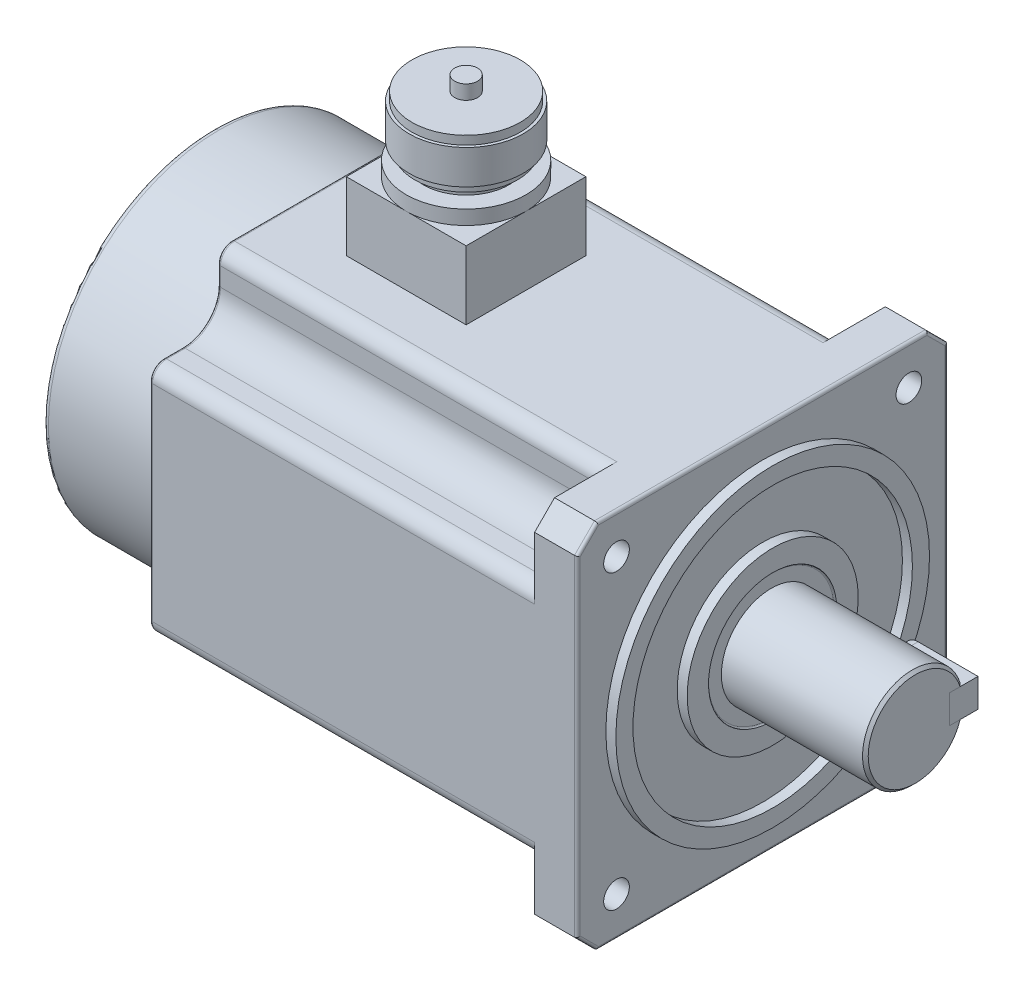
SolidWorks part; units mm, degrees
ref_plane "前视基准面" through (0, 0, 0) normal (0, 0, 1) x (1, 0, 0)
ref_plane "上视基准面" through (0, 0, 0) normal (0, 1, 0) x (1, 0, 0)
ref_plane "右视基准面" through (0, 0, 0) normal (1, 0, 0) x (0, 0, -1)
sketch "草图1" plane through (0, 0, 0) normal (1, 0, 0) x (0, 0, -1)
  line L0 (-65, 58) -> (-58, 65)
  line L1 (-58, -65) -> (58, -65)
  line L2 (-65, -58) -> (-65, 58)
  line L3 (-58, 65) -> (58, 65)
  line L4 (65, -58) -> (65, 58)
  line L5 (-65, -65) -> (65, 65) construction
  line L6 (-65, 65) -> (65, -65) construction
  line L7 (-58, -65) -> (-65, -58)
  line L8 (58, -65) -> (65, -58)
  line L9 (65, 58) -> (58, 65)
  point P0 (0, 0)
extrude "凸台-拉伸1" add sketch "草图1" against normal blind 150
sketch "草图2" plane through (-150, 0, 0) normal (-1, 0, 0) x (0, 0, 1)
  line L0 (-53.5, 41.1509) -> (-60, 41.1509)
  line L1 (-36.1509, 65) -> (-58, 65)
  line L2 (-41.1509, 53.5) -> (-41.1509, 60)
  line L3 (-58, 65) -> (58, 65) construction
  line L4 (-58, 65) -> (-65, 58)
  line L5 (41.1509, 60) -> (41.1509, 53.5)
  line L6 (-65, 58) -> (-58, 65) construction
  line L7 (-65, -58) -> (-65, 58) construction
  line L8 (53.5, 41.1509) -> (60, 41.1509)
  line L9 (-60, -41.1509) -> (-53.5, -41.1509)
  line L10 (-41.1509, -53.5) -> (-41.1509, -60)
  line L11 (58, -65) -> (-58, -65) construction
  line L12 (65, 58) -> (65, -58) construction
  line L13 (-65, 58) -> (-65, 36.1509)
  line L14 (60, -41.1509) -> (53.5, -41.1509)
  line L15 (-65, -36.1509) -> (-65, -58)
  line L16 (41.1509, -53.5) -> (41.1509, -60)
  line L17 (-65, -58) -> (-58, -65)
  line L18 (-58, -65) -> (-36.1509, -65)
  line L19 (36.1509, -65) -> (58, -65)
  line L20 (58, -65) -> (65, -58)
  line L21 (65, -58) -> (65, -36.1509)
  line L22 (65, 36.1509) -> (65, 58)
  line L23 (65, 58) -> (58, 65)
  line L24 (58, 65) -> (36.1509, 65)
  arc A0 (-53.5, 41.1509) -> (-41.1509, 53.5) centre (-53.5, 53.5) ccw
  arc A1 (41.1509, 53.5) -> (53.5, 41.1509) centre (53.5, 53.5) ccw
  arc A2 (53.5, -41.1509) -> (41.1509, -53.5) centre (53.5, -53.5) ccw
  arc A3 (-41.1509, -53.5) -> (-53.5, -41.1509) centre (-53.5, -53.5) ccw
  arc A4 (-41.1509, 60) -> (-36.1509, 65) centre (-36.1509, 60) cw
  arc A5 (36.1509, 65) -> (41.1509, 60) centre (36.1509, 60) cw
  arc A6 (60, 41.1509) -> (65, 36.1509) centre (60, 36.1509) cw
  arc A7 (65, -36.1509) -> (60, -41.1509) centre (60, -36.1509) cw
  arc A8 (36.1509, -65) -> (41.1509, -60) centre (36.1509, -60) ccw
  arc A9 (-36.1509, -65) -> (-41.1509, -60) centre (-36.1509, -60) cw
  arc A10 (-60, -41.1509) -> (-65, -36.1509) centre (-60, -36.1509) cw
  arc A11 (-65, 36.1509) -> (-60, 41.1509) centre (-60, 36.1509) cw
  point P0 (0, 0)
  point P10 (-41.1509, 65)
  point P39 (41.1509, 65)
  point P42 (65, 41.1509)
  point P45 (65, -41.1509)
  point P48 (41.1509, -65)
  point P51 (-41.1509, -65)
  point P54 (-65, -41.1509)
  point P57 (-65, 41.1509)
  dimension "D1" = 5
extrude "切除-拉伸1" cut sketch "草图2" against normal blind 135
fillet "圆角1" radius 1 8 edges at (0, 61.5, -61.5) (0, 0, -65) (0, -61.5, -61.5) (0, -65, 0) (0, -61.5, 61.5) (0, 0, 65) (0, 61.5, 61.5) (0, 65, 0)
fillet "圆角2" radius 1 24 edges at (-150, -44.7679, 44.7679) (-150, -56.75, 41.1509) (-150, -63.5355, 39.6864) (-150, -65, 0) (-150, -63.5355, -39.6864) (-150, -56.75, -41.1509) (-150, -44.7679, -44.7679) (-150, -41.1509, -56.75) (-150, -39.6864, -63.5355) (-150, 0, -65) (-150, 39.6864, -63.5355) (-150, 41.1509, -56.75) (-150, 44.7679, -44.7679) (-150, 56.75, -41.1509) (-150, 63.5355, -39.6864) (-150, 65, 0) (-150, 63.5355, 39.6864) (-150, 56.75, 41.1509) (-150, 44.7679, 44.7679) (-150, 41.1509, 56.75) (-150, 39.6864, 63.5355) (-150, 0, 65) (-150, -39.6864, 63.5355) (-150, -41.1509, 56.75)
sketch "草图3" plane through (-150, 0, 0) normal (-1, 0, 0) x (0, 0, 1)
  circle A0 centre (0, 0) radius 60
extrude "凸台-拉伸2" add sketch "草图3" along normal blind 42.5
fillet "圆角3" radius 2 1 edges at (-192.5, 0, 60)
sketch "草图4" plane through (0, 0, 0) normal (1, 0, 0) x (0, 0, -1)
  circle A1 centre (-51.2652, 51.2652) radius 4.5
  circle A2 centre (51.2652, 51.2652) radius 4.5
  circle A3 centre (51.2652, -51.2652) radius 4.5
  circle A4 centre (-51.2652, -51.2652) radius 4.5
extrude "切除-拉伸2" cut sketch "草图4" against normal blind 15
sketch "草图5" plane through (0, 0, 0) normal (1, 0, 0) x (0, 0, -1)
  circle A0 centre (0, 0) radius 55
  circle A1 centre (0, 0) radius 49
extrude "凸台-拉伸3" add sketch "草图5" along normal blind 3.5 separate body
sketch "草图6" plane through (0, 0, 0) normal (1, 0, 0) x (0, 0, -1)
  circle A0 centre (0, 0) radius 30
extrude "凸台-拉伸4" add sketch "草图6" along normal blind 3.5
sketch "草图7" plane through (3.5, 0, 0) normal (1, 0, 0) x (0, 0, -1)
  circle A0 centre (0, 0) radius 22.5
extrude "切除-拉伸3" cut sketch "草图7" against normal blind 0.5
sketch "草图8" plane through (3, 0, 0) normal (1, 0, 0) x (0, 0, -1)
  circle A0 centre (0, 0) radius 17.5
extrude "凸台-拉伸5" add sketch "草图8" along normal blind 50.5
fillet "圆角4" radius 0.5 1 edges at (3, 0, -22.5)
ref_plane "基准面1" through (0, 0, -17.5) normal (0, 0, 1) x (1, 0, 0)
sketch "草图9" plane through (0, 0, -17.5) normal (0, 0, 1) x (1, 0, 0)
  line L1 (53.5, -17.5) -> (53.5, 17.5) construction
  line L2 (32.5, 5) -> (53.5, 5)
  line L3 (53.5, 5) -> (53.5, -5)
  line L4 (53.5, -5) -> (32.5, -5)
  arc A0 (32.5, 5) -> (32.5, -5) centre (32.5, 0) ccw
extrude "切除-拉伸5" cut sketch "草图9" along normal blind 5.5
sketch "草图10" plane through (0, 0, -12) normal (0, 0, -1) x (-1, 0, 0)
  line L0 (-32.5, 5) -> (-53.5, 5)
  line L1 (-53.5, 5) -> (-53.5, -5)
  line L2 (-53.5, -5) -> (-32.5, -5)
  arc A0 (-32.5, -5) -> (-32.5, 5) centre (-32.5, 0) ccw
extrude "凸台-拉伸6" add sketch "草图10" along normal blind 10 separate body
chamfer "倒角1" distance 1 angle 45 1 edges at (53.5, 0, 17.5)
sketch "草图12" plane through (0, 65, 0) normal (0, 1, 0) x (1, 0, 0)
  line L3 (-125, -21) -> (-83, -21)
  line L4 (-125, -21) -> (-125, 21)
  line L5 (-125, 21) -> (-83, 21)
  line L6 (-83, -21) -> (-83, 21)
  line L7 (-125, -21) -> (-83, 21) construction
  line L8 (-125, 21) -> (-83, -21) construction
extrude "凸台-拉伸7" add sketch "草图12" along normal blind 24
sketch "草图13" plane through (0, 89, 0) normal (0, 1, 0) x (1, 0, 0)
  circle A0 centre (-104, 0) radius 21
extrude "凸台-拉伸8" add sketch "草图13" along normal blind 5
sketch "草图14" plane through (0, 94, 0) normal (0, 1, 0) x (1, 0, 0)
  circle A0 centre (-104, 0) radius 15
extrude "凸台-拉伸9" add sketch "草图14" along normal blind 3
sketch "草图15" plane through (0, 97, 0) normal (0, 1, 0) x (1, 0, 0)
  circle A0 centre (-104, 0) radius 18
extrude "凸台-拉伸10" add sketch "草图15" along normal blind 3
sketch "草图16" plane through (0, 100, 0) normal (0, 1, 0) x (1, 0, 0)
  circle A0 centre (-104, 0) radius 20
extrude "凸台-拉伸11" add sketch "草图16" along normal blind 12
sketch "草图17" plane through (0, 112, 0) normal (0, 1, 0) x (1, 0, 0)
  circle A0 centre (-104, 0) radius 19
extrude "凸台-拉伸12" add sketch "草图17" along normal blind 3
sketch "草图18" plane through (0, 115, 0) normal (0, 1, 0) x (1, 0, 0)
  circle A0 centre (-104, 0) radius 4
extrude "凸台-拉伸13" add sketch "草图18" along normal blind 5
